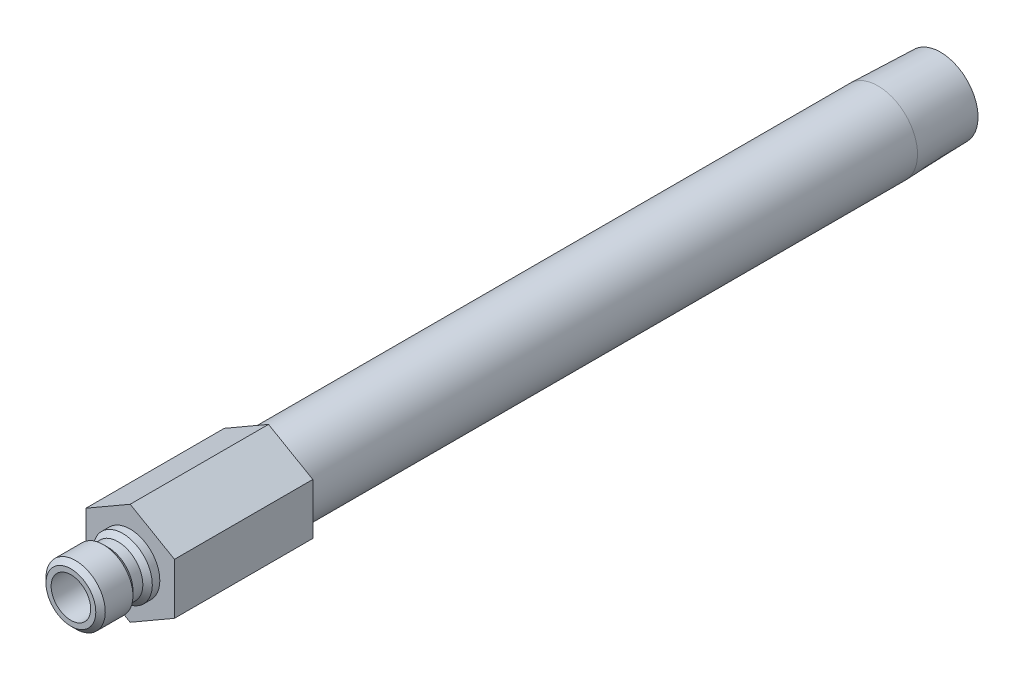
SolidWorks part; units mm, degrees
ref_plane "Front Plane" through (0, 0, 0) normal (0, 0, 1) x (1, 0, 0)
ref_plane "Top Plane" through (0, 0, 0) normal (0, 1, 0) x (1, 0, 0)
ref_plane "Right Plane" through (0, 0, 0) normal (1, 0, 0) x (0, 0, -1)
sketch "Sketch1" plane through (0, 0, 0) normal (1, 0, 0) x (0, 0, -1)
  line L0 (0, 0) -> (-12.7, 0) construction
  line L1 (-9.525, 3.175) -> (-9.525, 4.0005)
  line L2 (-3.556, 4.0005) -> (-3.556, 0) construction
  line L3 (-8.763, 4.7625) -> (-4.318, 4.7625)
  line L4 (0, 6.35) -> (0, 0) construction
  line L5 (-3.556, 4.0005) -> (-1.9685, 4.0005)
  line L6 (-1.2065, 4.7625) -> (0, 4.7625)
  line L7 (0, 4.7625) -> (0, 6.35)
  line L8 (-3.556, 4.0005) -> (-4.318, 4.7625)
  line L9 (-1.9685, 4.0005) -> (-1.2065, 4.7625)
  line L10 (-9.525, 4.0005) -> (-8.763, 4.7625)
  line L11 (22.225, 4.6228) -> (130.175, 4.6228)
  line L12 (0, 6.35) -> (120.142, 6.35)
  line L13 (120.142, 6.35) -> (130.175, 6.0365)
  line L14 (130.175, 6.0365) -> (130.175, 4.6228)
  line L15 (0, 0) -> (22.225, 0) construction
  line L16 (22.225, 0) -> (22.225, 4.7625) construction
  line L17 (22.225, 4.7625) -> (0, 4.7625) construction
  line L18 (22.225, 4.6228) -> (22.225, 3.175)
  line L19 (22.225, 3.175) -> (-9.525, 3.175)
  dimension "D1" = 9.525
  dimension "D2" = 1.5875
  dimension "D3" = 0.762
  dimension "D4" = 45
  dimension "D5" = 5.969
  dimension "D6" = 45
  dimension "D7" = 1.79
  dimension "D8" = 10.033
  dimension "D9" = 139.7
  dimension "D10" = 3.175
  dimension "D11" = 31.75
  dimension "D12" = 9.2456
  dimension "D13" = 6.35
  dimension "D14" = 9.525
  dimension "D15" = 12.7
revolve "Revolve1" add sketch "Sketch1" angle 360 about L0
sketch "Sketch2" plane through (0, 0, 0) normal (0, 0, 1) x (1, 0, 0)
  line L1 (-7.112, 4.1061) -> (-7.112, -4.1061)
  line L2 (-7.112, -4.1061) -> (0, -8.2122)
  line L3 (0, -8.2122) -> (7.112, -4.1061)
  line L4 (7.112, -4.1061) -> (7.112, 4.1061)
  line L5 (7.112, 4.1061) -> (0, 8.2122)
  line L6 (0, 8.2122) -> (-7.112, 4.1061)
  circle A0 centre (0, 0) radius 7.112 construction
  circle A1 centre (0, 0) radius 3.175 construction
  circle A2 centre (0, 0) radius 3.175
  dimension "D1" = 14.224
extrude "Boss-Extrude1" add sketch "Sketch2" against normal up to vertex (22.225 mm away) from vertex at 0
